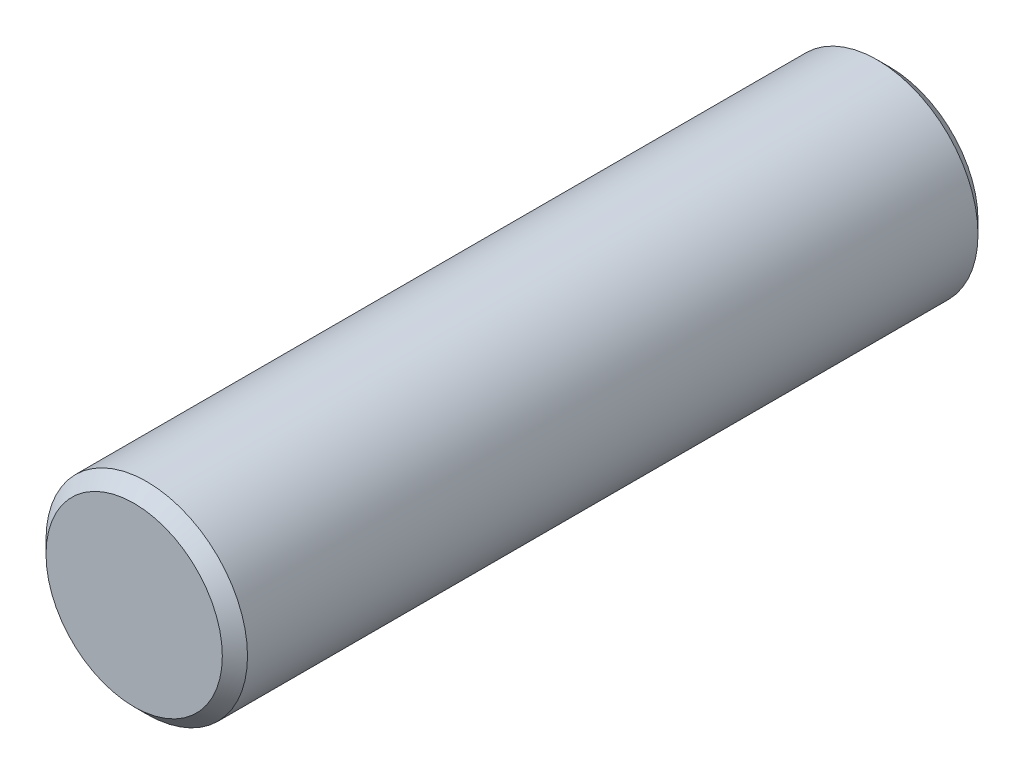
SolidWorks part; units mm, degrees
ref_plane "Plan de face" through (0, 0, 0) normal (0, 0, 1) x (1, 0, 0)
ref_plane "Plan de dessus" through (0, 0, 0) normal (0, 1, 0) x (1, 0, 0)
ref_plane "Plan de droite" through (0, 0, 0) normal (1, 0, 0) x (0, 0, -1)
sketch "Esquisse1" plane through (0, 0, 0) normal (0, 0, 1) x (1, 0, 0)
  circle A0 centre (0, 0) radius 8
  dimension "D1" = 16
extrude "Boss.-Extru.1" add sketch "Esquisse1" along normal blind 60
chamfer "Chanfrein1" distance 1 angle 45 2 edges at (8, 0, 0) (8, 0, 60)
